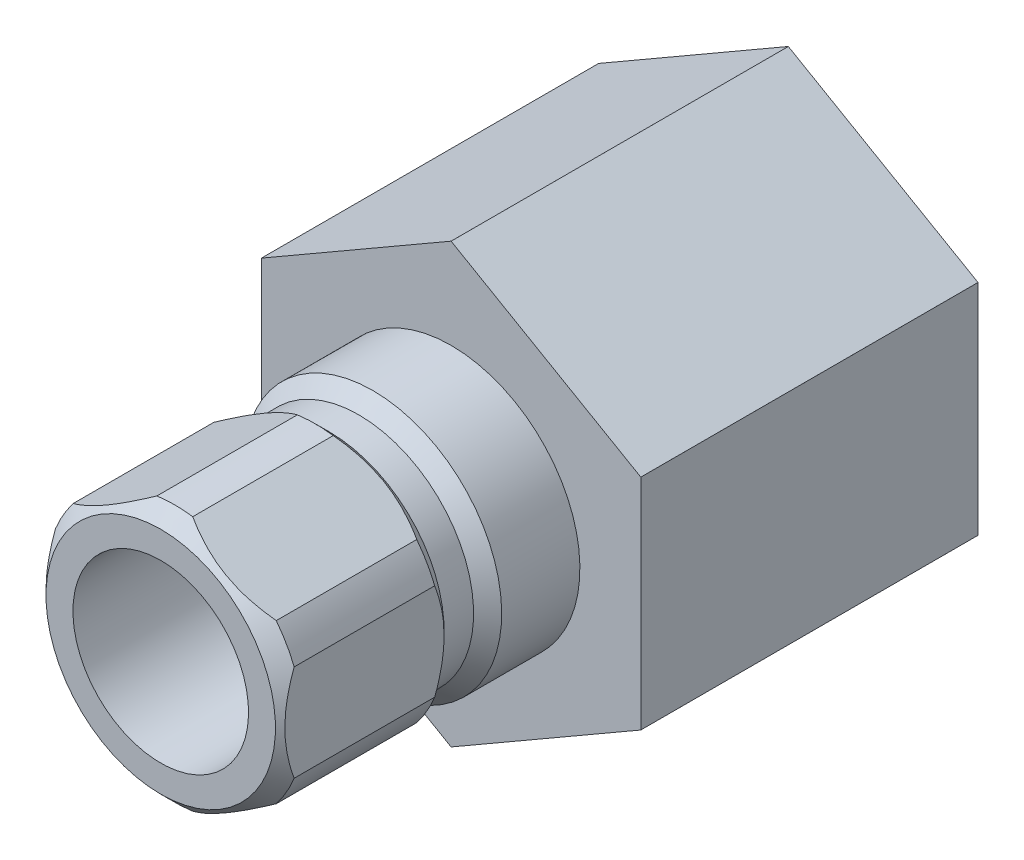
SolidWorks part; units mm, degrees
ref_plane "Front Plane" through (0, 0, 0) normal (0, 0, 1) x (1, 0, 0)
ref_plane "Top Plane" through (0, 0, 0) normal (0, 1, 0) x (1, 0, 0)
ref_plane "Right Plane" through (0, 0, 0) normal (1, 0, 0) x (0, 0, -1)
sketch "Sketch1" plane through (0, 0, 0) normal (1, 0, 0) x (0, 0, -1)
  line L0 (0, 0) -> (-18.923, 0) construction
  line L1 (-15.748, 4.7625) -> (-15.748, 6.223)
  line L2 (-6.604, 6.223) -> (-6.604, 0) construction
  line L3 (-14.986, 6.985) -> (-7.366, 6.985)
  line L4 (0, 11.8783) -> (0, 0) construction
  line L5 (-6.604, 6.223) -> (-5.0038, 6.223)
  line L6 (-4.2418, 6.985) -> (0, 6.985)
  line L7 (0, 6.985) -> (0, 11.8783)
  line L8 (-6.604, 6.223) -> (-7.366, 6.985)
  line L9 (-5.0038, 6.223) -> (-4.2418, 6.985)
  line L10 (-15.748, 6.223) -> (-14.986, 6.985)
  line L11 (-15.748, 4.7625) -> (6.3627, 4.7625)
  line L12 (0, 11.8783) -> (18.288, 11.8783)
  line L13 (6.3627, 4.7625) -> (6.3627, 7.3419)
  line L14 (18.288, 11.8783) -> (18.288, 7.7145)
  line L15 (6.3627, 7.3419) -> (18.288, 7.7145)
  dimension "D1" = 15.748
  dimension "D2" = 1.6002
  dimension "D3" = 0.762
  dimension "D4" = 45
  dimension "D5" = 9.144
  dimension "D6" = 45
  dimension "D7" = 1.79
  dimension "D8" = 14.6837
  dimension "D9" = 34.036
  dimension "D10" = 3.175
  dimension "D11" = 9.525
  dimension "D12" = 11.9253
  dimension "D13" = 23.7566
  dimension "D14" = 13.97
revolve "Revolve1" add sketch "Sketch1" angle 360 about L0
sketch "Sketch2" plane through (0, 0, 0) normal (0, 0, 1) x (1, 0, 0)
  line L1 (-10.287, 5.9392) -> (-10.287, -5.9392)
  line L2 (-10.287, -5.9392) -> (0, -11.8784)
  line L3 (0, -11.8784) -> (10.287, -5.9392)
  line L4 (10.287, -5.9392) -> (10.287, 5.9392)
  line L5 (10.287, 5.9392) -> (0, 11.8784)
  line L6 (0, 11.8784) -> (-10.287, 5.9392)
  circle A0 centre (0, 0) radius 10.287 construction
  dimension "D1" = 20.574
extrude "Cut-Extrude1" cut sketch "Sketch2" against normal through all flip side to cut
sketch "Sketch3" plane through (0, 0, 0) normal (0, 0, 1) x (1, 0, 0)
  line L1 (-6.477, 3.7395) -> (-6.477, -3.7395)
  line L2 (-6.477, -3.7395) -> (0, -7.479)
  line L3 (0, -7.479) -> (6.477, -3.7395)
  line L4 (6.477, -3.7395) -> (6.477, 3.7395)
  line L5 (6.477, 3.7395) -> (0, 7.479)
  line L6 (0, 7.479) -> (-6.477, 3.7395)
  circle A0 centre (0, 0) radius 6.477 construction
  dimension "D1" = 12.954
extrude "Cut-Extrude2" cut sketch "Sketch3" along normal through all from vertex at 6.604 flip side to cut
